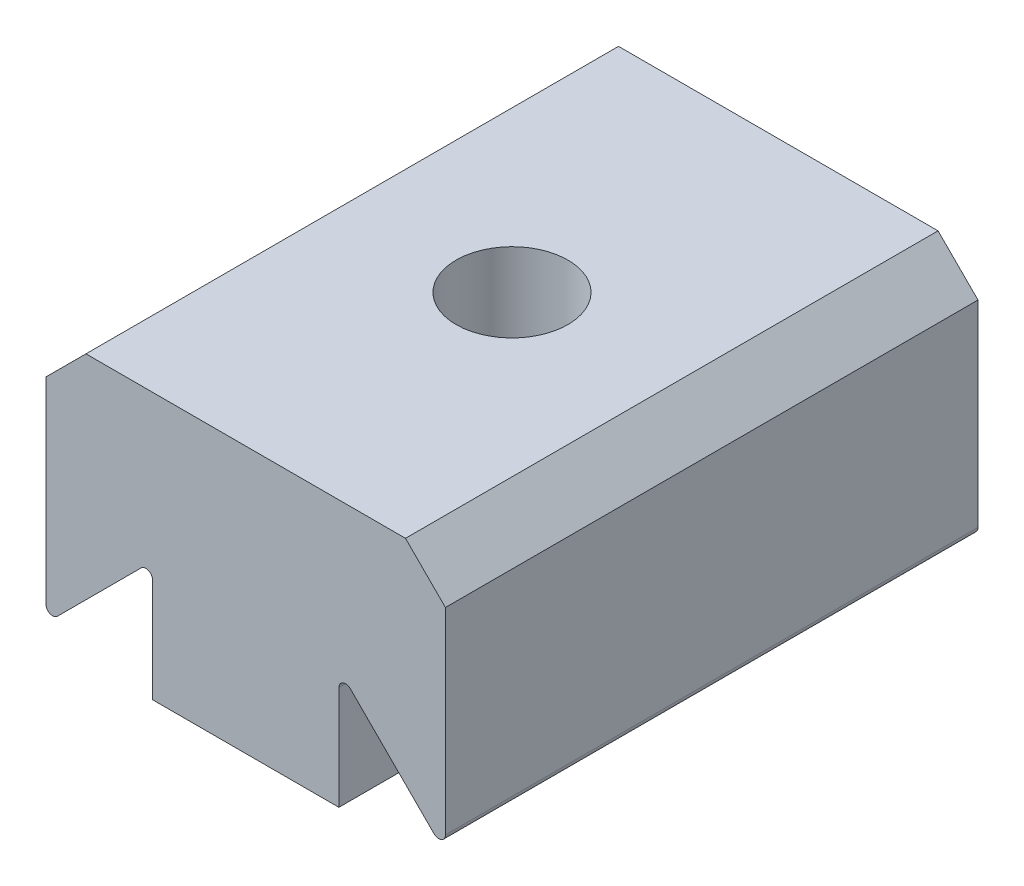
SolidWorks part; units mm, degrees
ref_plane "Face" through (0, 0, 0) normal (0, 0, 1) x (1, 0, 0)
ref_plane "Dessus" through (0, 0, 0) normal (0, 1, 0) x (1, 0, 0)
ref_plane "Droite" through (0, 0, 0) normal (1, 0, 0) x (0, 0, -1)
sketch "Esquisse1" plane through (0, 0, 0) normal (0, 0, 1) x (1, 0, 0)
  line L0 (-11, 26.5) -> (4, 26.5)
  line L2 (-11, 26.5) -> (-11, 16.5)
  line L3 (4, 26.5) -> (4, 16.5)
  line L4 (-11, 16.5) -> (4, 16.5)
  line L5 (0, 20) -> (0, -20) construction
  dimension "D1" = 26.5
  dimension "D2" = 10
  dimension "D3" = 4
  dimension "D4" = 15
extrude "Extrusion1" add sketch "Esquisse1" along normal mid plane 20
sketch "Esquisse3" plane through (0, 0, 10) normal (0, 0, 1) x (1, 0, 0)
  line L0 (8, 13) -> (1, 20) construction
  line L1 (0, 20) -> (0, -20) construction
  line L2 (3.5732, 17.4268) -> (0.4268, 20.5732)
  line L3 (0, 20.3964) -> (0, 11.2369)
  line L4 (4, 16.5) -> (4, 26.5) construction
  line L5 (4, 17.6036) -> (4, 22.0518)
  line L6 (4, 22.0518) -> (14.3389, 16.7254)
  line L7 (14.3389, 16.7254) -> (9.984, 8.2722)
  line L8 (9.984, 8.2722) -> (0, 11.2369)
  arc A0 (0.4268, 20.5732) -> (0, 20.3964) centre (0.25, 20.3964) ccw
  arc A1 (4, 17.6036) -> (3.5732, 17.4268) centre (3.75, 17.6036) cw
  dimension "D1" = 0.25
extrude "Enlèv. mat.-Extru.1" cut sketch "Esquisse3" against normal through all
ref_plane "Plan1" through (-3.5, 0, 0) normal (-1, 0, 0) x (0, 0, 1)
mirror "Symétrie1" about plane through (-3.5, 0, 0) normal (-1, 0, 0)
chamfer "Chanfrein1" distance 1.5 angle 45
hole_wizard "Trou taraudé M5x0.81" positions "Esquisse5" profile "Esquisse4" tap size "M5x0.8" standard "ISO"
sketch "Esquisse5" plane through (0, 26.5, 0) normal (0, 1, 0) x (-1, 0, 0)
  line L0 (-7.8556, 0) -> (14.1378, 0) construction
  line L1 (-4, -10) -> (-4, 10) construction
  point P0 (3.5, 0)
  dimension "D1" = 7.5
sketch "Esquisse4" plane through (-3.5, 26.5, 0) normal (1, 0, 0) x (0, 0, 1)
  line L0 (0, 0) -> (0, 10)
  line L1 (0, 10) -> (2.1, 10)
  line L2 (2.1, 10) -> (2.1, 0)
  line L5 (2.1, 0) -> (0, 0)
  line L11 (0, -6.35) -> (0, 107.95) construction
  dimension "Diamètre du trou pour taraudage jusqu'au prochain" = 4.2
  dimension "Profondeur du trou pour taraudage jusqu'au prochain" = 10
